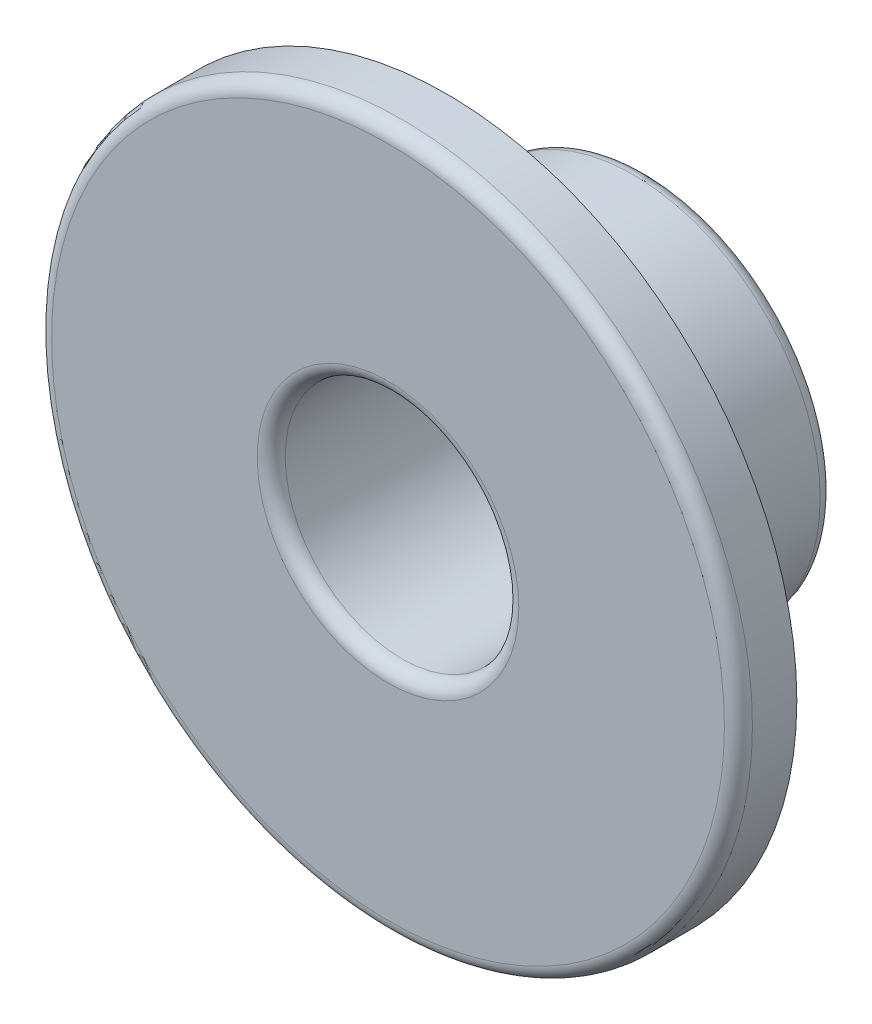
SolidWorks part; units mm, degrees
ref_plane "Front" through (0, 0, 0) normal (0, 0, 1) x (1, 0, 0)
ref_plane "Top" through (0, 0, 0) normal (0, 1, 0) x (1, 0, 0)
ref_plane "Right" through (0, 0, 0) normal (1, 0, 0) x (0, 0, -1)
sketch "Sketch1" plane through (0, 0, 0) normal (0, 0, 1) x (1, 0, 0)
  circle A0 centre (0, 0) radius 19.05
  arc A1 (-19.05, 0) -> (19.05, 0) centre (0, 0) ccw construction
extrude "Extrude1" add sketch "Sketch1" along normal blind 3.175
sketch "Sketch2" plane through (0, 0, 0) normal (0, 0, -1) x (-1, 0, 0)
  circle A0 centre (0, 0) radius 10.16 construction
  circle A1 centre (0, 0) radius 10.16
extrude "Extrude2" add sketch "Sketch2" along normal blind 10.922
sketch "Sketch3" plane through (0, 0, 3.175) normal (0, 0, 1) x (1, 0, 0)
  circle A0 centre (0, 0) radius 6.35
  dimension "D1" = 12.7
extrude "Cut-Extrude1" cut sketch "Sketch3" against normal through all
fillet "Fillet1" radius 0.762 4 edges at (19.05, 0, 3.175) (-10.16, 0, -10.922) (6.35, 0, 3.175) (6.35, 0, -10.922)
